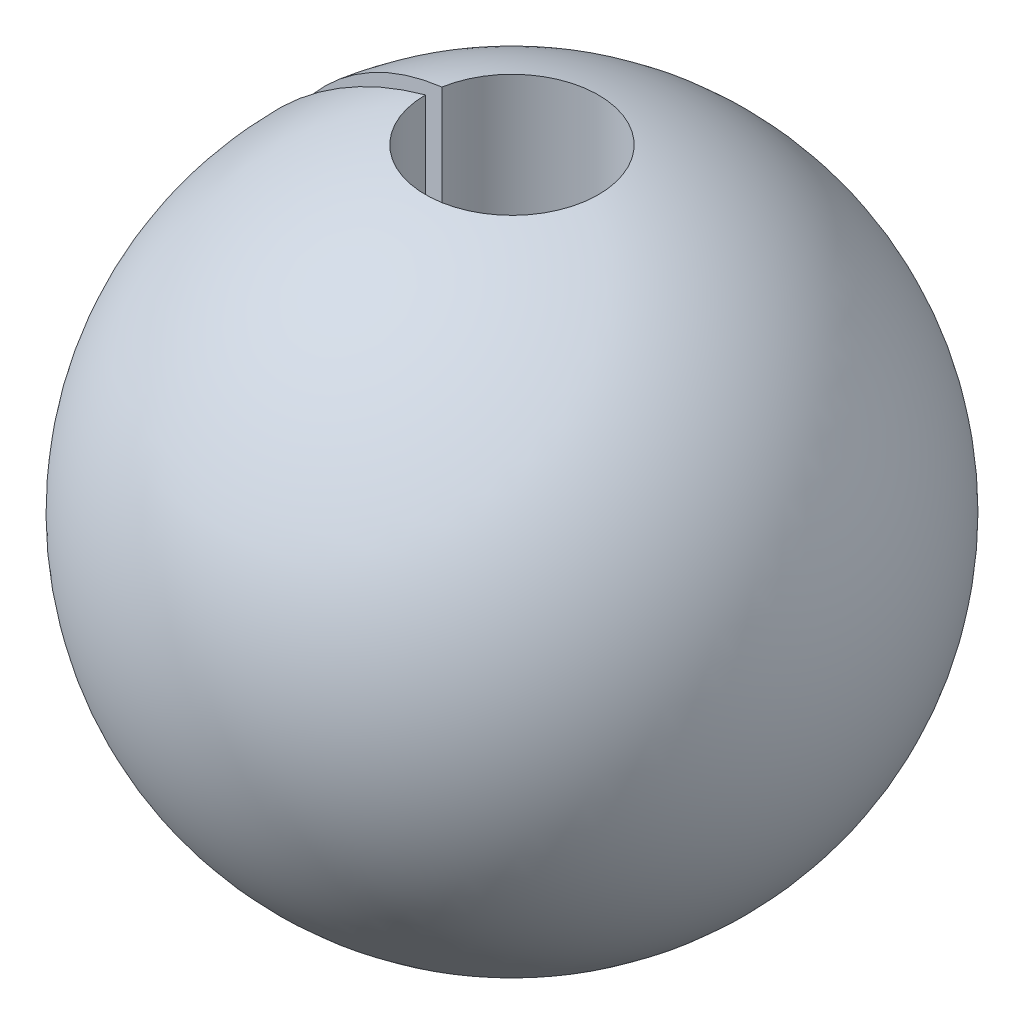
SolidWorks part; units mm, degrees
ref_plane "前视基准面" through (0, 0, 0) normal (0, 0, 1) x (1, 0, 0)
ref_plane "上视基准面" through (0, 0, 0) normal (0, 1, 0) x (1, 0, 0)
ref_plane "右视基准面" through (0, 0, 0) normal (1, 0, 0) x (0, 0, -1)
sketch "草图2" plane through (0, 0, 0) normal (0, 0, 1) x (1, 0, 0)
  line L0 (0, -1000) -> (0, 49000) construction
  line L1 (-368, 1353.8778) -> (-368, -1353.8778)
  arc A0 (-368, 1353.8778) -> (-368, -1353.8778) centre (0, 0) ccw
  dimension "D1" = 1403
  dimension "D2" = 368
revolve "旋转1" add sketch "草图2" angle 350 about L0
